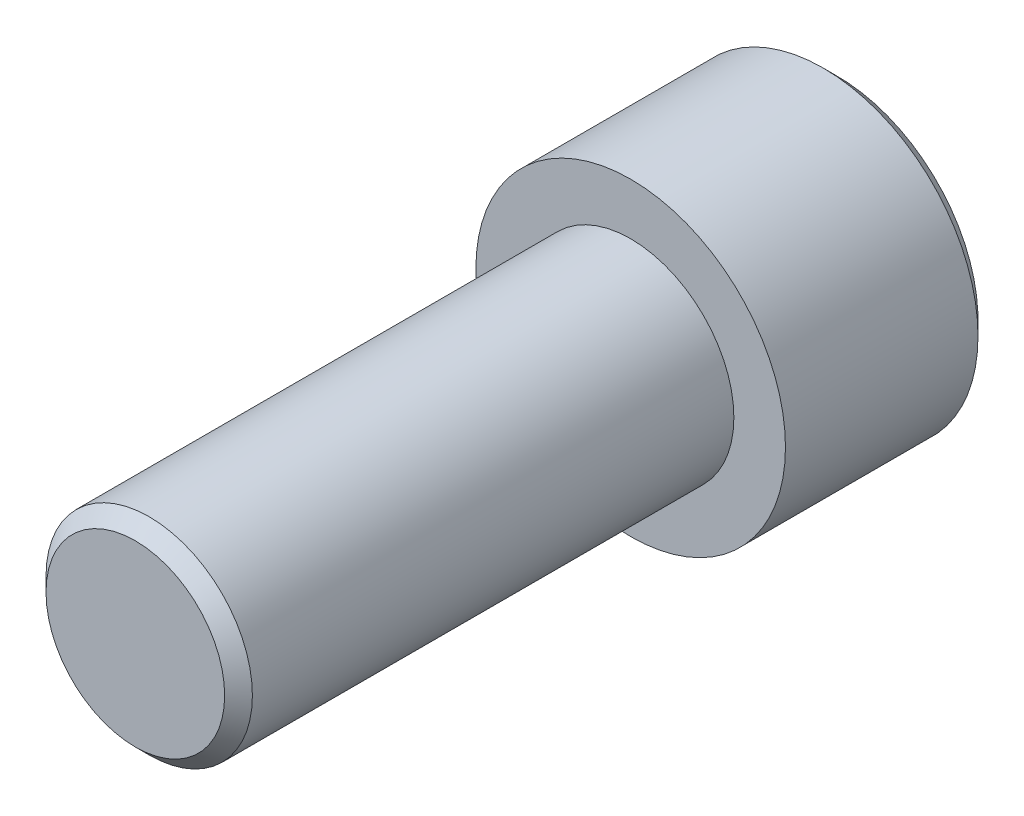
SolidWorks part; units mm, degrees
ref_plane "Front Plane" through (0, 0, 0) normal (0, 0, 1) x (1, 0, 0)
ref_plane "Top Plane" through (0, 0, 0) normal (0, 1, 0) x (1, 0, 0)
ref_plane "Right Plane" through (0, 0, 0) normal (1, 0, 0) x (0, 0, -1)
sketch "Sketch1" plane through (0, 0, 0) normal (0, 1, 0) x (1, 0, 0)
  line L0 (0, -19.05) -> (3.9688, -19.05)
  line L1 (3.9688, -19.05) -> (3.9688, 0)
  line L2 (3.9688, 0) -> (5.9531, 0)
  line L3 (5.9531, 0) -> (5.9531, 7.9375)
  line L4 (5.9531, 7.9375) -> (0, 7.9375)
  line L5 (0, -19.05) -> (0, 0)
  line L6 (0, 0) -> (0, 7.9375)
  dimension "D1" = 3.9688
  dimension "D2" = 5.9531
  dimension "D3" = 7.9375
  dimension "D4" = 19.05
revolve "Revolve1" add sketch "Sketch1" angle 360 about L5
sketch "Sketch2" plane through (0, 0, -7.9375) normal (0, 0, -1) x (-1, 0, 0)
  line L1 (-3.1825, -1.82) -> (-0.0151, -3.6661)
  line L2 (-0.0151, -3.6661) -> (3.1674, -1.8462)
  line L3 (3.1674, -1.8462) -> (3.1825, 1.82)
  line L4 (3.1825, 1.82) -> (0.0151, 3.6661)
  line L5 (0.0151, 3.6661) -> (-3.1674, 1.8462)
  line L6 (-3.1674, 1.8462) -> (-3.1825, -1.82)
  circle A0 centre (0, 0) radius 3.175 construction
  circle A1 centre (0, 0) radius 5.9531 construction
  dimension "D1" = 6.35
extrude "Cut-Extrude1" cut sketch "Sketch2" against normal blind 6.35
chamfer "Chamfer2" distance 0.5334 angle 45 1 edges at (5.9531, 0, -7.9375)
chamfer "Chamfer3" distance 0.5334 angle 45 1 edges at (3.9688, 0, 19.05)
